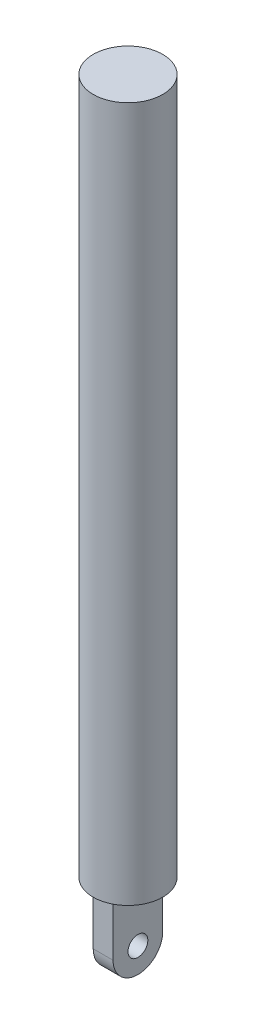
SolidWorks part; units mm, degrees
ref_plane "前视基准面" through (0, 0, 0) normal (0, 0, 1) x (1, 0, 0)
ref_plane "上视基准面" through (0, 0, 0) normal (0, 1, 0) x (1, 0, 0)
ref_plane "右视基准面" through (0, 0, 0) normal (1, 0, 0) x (0, 0, -1)
sketch "草图1" plane through (0, 0, 0) normal (0, 1, 0) x (1, 0, 0)
  circle A0 centre (0, 0) radius 35
  dimension "D1" = 70
extrude "凸台-拉伸1" add sketch "草图1" along normal blind 700
sketch "草图3" plane through (0, 0, 0) normal (0, 0, 1) x (1, 0, 0)
  line L0 (0, 0) -> (0, -80) construction
  line L1 (-35, 0) -> (35, 0) construction
  line L2 (-10, -80) -> (10, -80)
  line L3 (-10, -80) -> (-10, 0)
  line L4 (-10, 0) -> (10, 0)
  line L5 (10, -80) -> (10, 0)
  line L6 (-10, -80) -> (10, 0) construction
  line L7 (-10, 0) -> (10, -80) construction
  point P3 (0, -40)
  dimension "D1" = 80
  dimension "D2" = 20
extrude "凸台-拉伸2" add sketch "草图3" along normal mid plane 50
fillet "圆角1" radius 25 2 edges at (0, -80, -25) (0, -80, 25)
sketch "草图4" plane through (10, 0, 0) normal (1, 0, 0) x (0, 0, -1)
  circle A0 centre (0, -55) radius 10
  dimension "D1" = 20
extrude "切除-拉伸1" cut sketch "草图4" against normal blind 80
